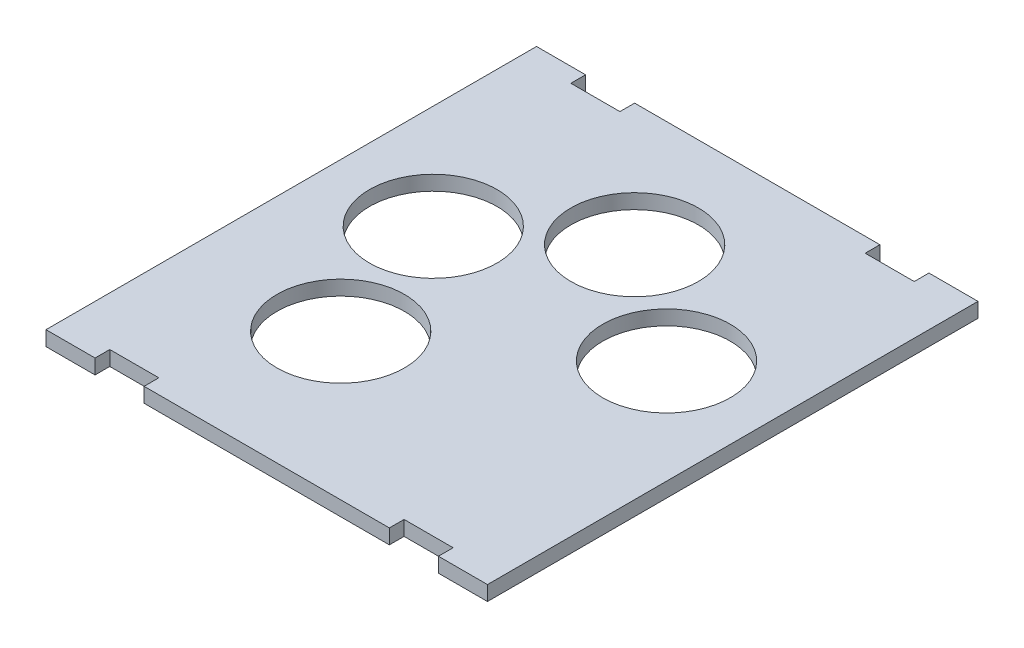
SolidWorks part; units mm, degrees
ref_plane "Front" through (0, 0, 0) normal (0, 0, 1) x (1, 0, 0)
ref_plane "Top" through (0, 0, 0) normal (0, 1, 0) x (1, 0, 0)
ref_plane "Right" through (0, 0, 0) normal (1, 0, 0) x (0, 0, -1)
sketch "草图1" plane through (0, 0, 0) normal (0, 1, 0) x (1, 0, 0)
  line L0 (-45, 50) -> (-45, -50)
  line L1 (-45, -50) -> (45, -50)
  line L2 (45, -50) -> (45, 50)
  line L3 (45, 50) -> (-45, 50)
  circle A0 centre (0, 25) radius 13
  circle A1 centre (23.7764, 7.7254) radius 13
  circle A3 centre (-14.6946, -20.2254) radius 13
  circle A4 centre (-23.7764, 7.7254) radius 13
  circle A5 centre (14.6946, -20.2254) radius 13
  point P4 (0, 50)
  point P7 (-45, 0)
  point P21 (0, 0)
  dimension "D3" = 25
  dimension "D4" = 26
  dimension "D1" = 100
  dimension "D2" = 90
  dimension "D5" = 5
extrude "凸台-拉伸1" add sketch "草图1" along normal blind 3
sketch "草图2" plane through (0, 3, 0) normal (0, 1, 0) x (1, 0, 0)
  line L0 (-35, 50) -> (-35, 47)
  line L1 (45, 50) -> (-45, 50) construction
  line L2 (-35, 47) -> (-25, 47)
  line L3 (-25, 47) -> (-25, 50)
  line L4 (-25, 50) -> (-35, 50)
  line L5 (25, 50) -> (25, 47)
  line L6 (25, 47) -> (35, 47)
  line L7 (35, 47) -> (35, 50)
  line L8 (35, 50) -> (25, 50)
  line L9 (25, -50) -> (25, -47)
  line L10 (-45, -50) -> (45, -50) construction
  line L11 (25, -47) -> (35, -47)
  line L12 (35, -47) -> (35, -50)
  line L13 (35, -50) -> (25, -50)
  line L14 (-35, -47) -> (-25, -47)
  line L15 (-25, -47) -> (-25, -50)
  line L16 (-25, -50) -> (-35, -50)
  line L17 (-35, -50) -> (-35, -47)
  dimension "D1" = 3
  dimension "D2" = 10
  dimension "D3" = 25
  dimension "D4" = 25
  dimension "D5" = 3
  dimension "D6" = 10
  dimension "D7" = 25
  dimension "D8" = 25
  dimension "D9" = 10
  dimension "D10" = 10
  dimension "D11" = 3
extrude "切除-拉伸1" cut sketch "草图2" against normal blind 3
